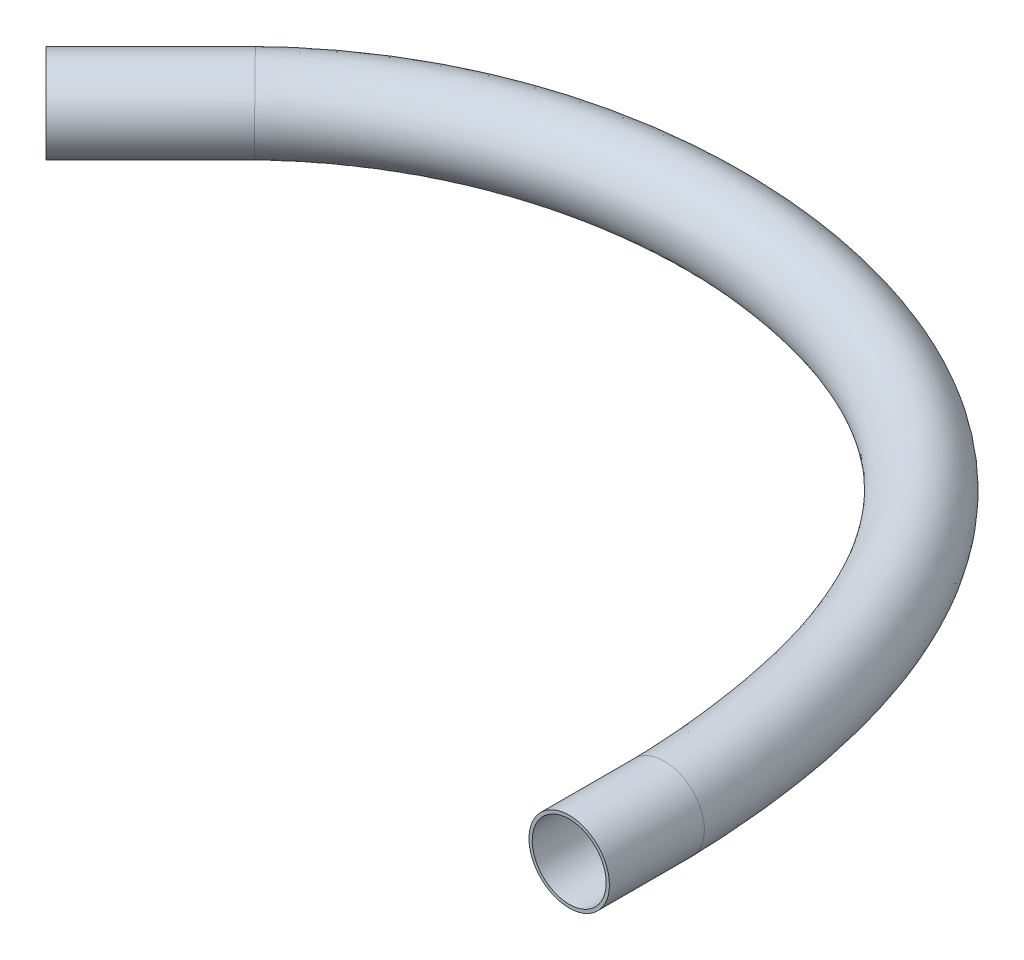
SolidWorks part; units mm, degrees
ref_plane "前视基准面" through (0, 0, 0) normal (0, 0, 1) x (1, 0, 0)
ref_plane "上视基准面" through (0, 0, 0) normal (0, 1, 0) x (1, 0, 0)
ref_plane "右视基准面" through (0, 0, 0) normal (1, 0, 0) x (0, 0, -1)
sketch "草图1" plane through (0, 0, 0) normal (0, 0, 1) x (1, 0, 0)
  circle A0 centre (0, 0) radius 21.75
  circle A1 centre (0, 0) radius 20
  dimension "D1" = 43.5
  dimension "D2" = 40
sketch "草图2" plane through (0, 0, 0) normal (0, 1, 0) x (1, 0, 0)
  line L0 (0, 0) -> (0, 51)
  line L1 (-440, 270.23) -> (-496.5685, 213.6615)
  spline S0 degree 3 poles (0, 51) (-4.8291, 198.0385) (-118.8648, 362.8955) (-361.2972, 345.932) (-440, 270.23) knots 0 0 0 0 0.523764 1 1 1 1
  dimension "D1" = 51
  dimension "D2" = 80
  dimension "D3" = 45
  dimension "D4" = 440
  dimension "D5" = 270.23
sweep "扫描1" add profiles "草图1" path "草图2"
